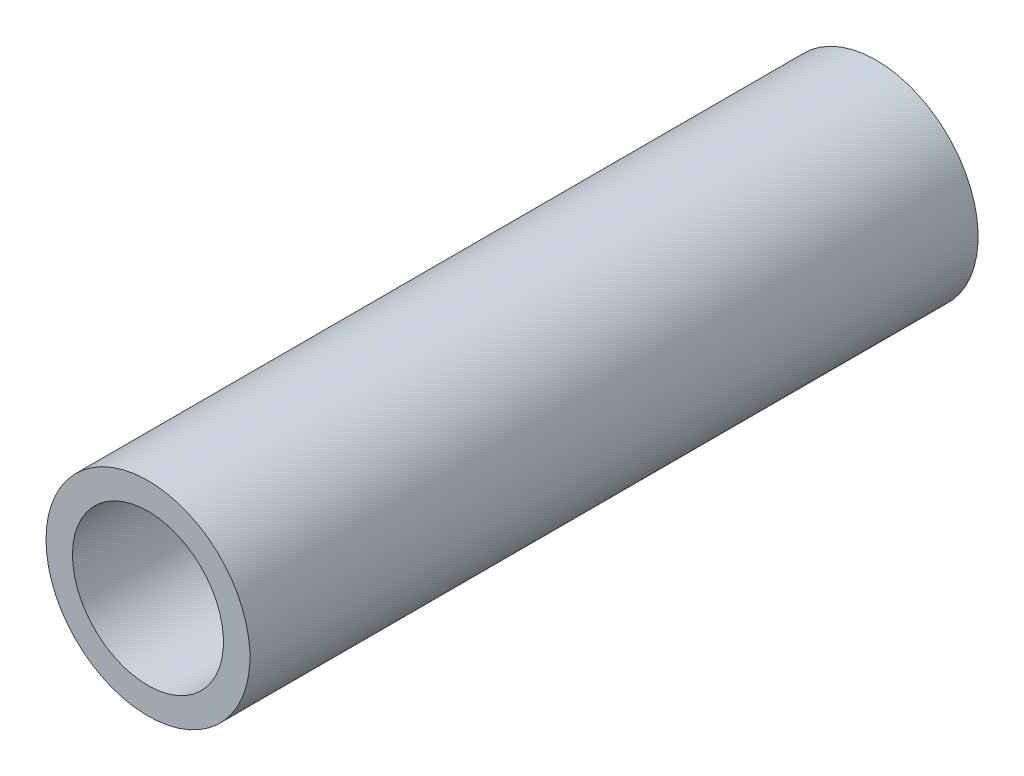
SolidWorks part; units mm, degrees
ref_plane "Front Plane" through (0, 0, 0) normal (0, 0, 1) x (1, 0, 0)
ref_plane "Top Plane" through (0, 0, 0) normal (0, 1, 0) x (1, 0, 0)
ref_plane "Right Plane" through (0, 0, 0) normal (1, 0, 0) x (0, 0, -1)
sketch "Sketch1" plane through (0, 0, 0) normal (0, 0, 1) x (1, 0, 0)
  circle A0 centre (0, 0) radius 10.668
  circle A1 centre (0, 0) radius 7.8994
  dimension "D1" = 21.336
  dimension "D2" = 2.7686
extrude "Extrude1" add sketch "Sketch1" along normal blind 76.2
